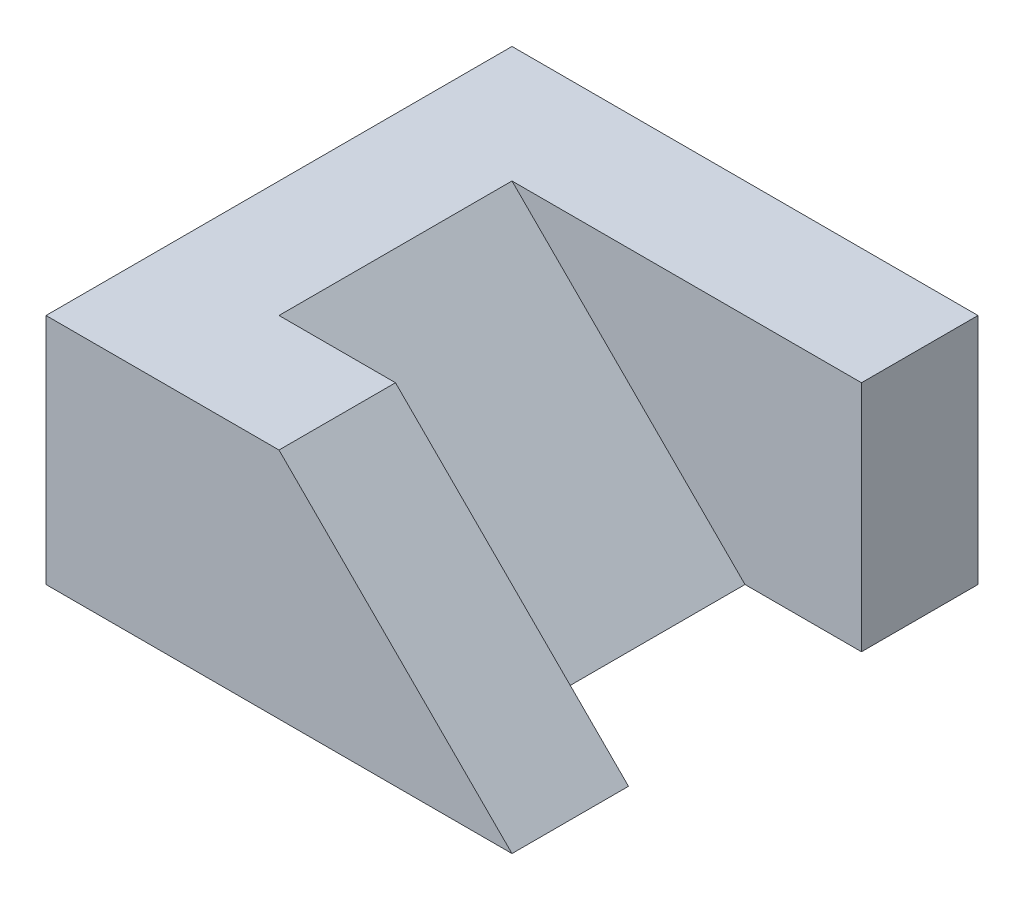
SolidWorks part; units mm, degrees
ref_plane "Front Plane" through (0, 0, 0) normal (0, 0, 1) x (1, 0, 0)
ref_plane "Top Plane" through (0, 0, 0) normal (0, 1, 0) x (1, 0, 0)
ref_plane "Right Plane" through (0, 0, 0) normal (1, 0, 0) x (0, 0, -1)
sketch "Sketch2" plane through (0, 0, 0) normal (0, 0, -1) x (1, 0, 0)
  line L0 (0, 0) -> (30, 0)
  line L1 (30, 0) -> (10, -20)
  line L2 (10, -20) -> (0, -20)
  line L3 (0, -20) -> (0, 0)
  dimension "D1" = 30
  dimension "D2" = 10
  dimension "D3" = 20
extrude "Extrude1" add sketch "Sketch2" along normal mid plane 20
sketch "Sketch3" plane through (0, 0, 10) normal (0, 0, 1) x (1, 0, 0)
  line L0 (0, 0) -> (40, 0)
  line L1 (40, 0) -> (20, 20)
  line L2 (20, 20) -> (0, 20)
  line L3 (0, 20) -> (0, 0)
  line L4 (10, 20) -> (30, 0) construction
  dimension "D1" = 40
extrude "Extrude2" add sketch "Sketch3" along normal blind 10
sketch "Sketch4" plane through (0, 0, -10) normal (0, 0, -1) x (-1, 0, 0)
  line L0 (0, 20) -> (-10, 20) construction
  line L1 (0, 0) -> (-40, 0)
  line L2 (0, 0) -> (0, 20)
  line L3 (0, 20) -> (-40, 20)
  line L4 (-40, 0) -> (-40, 20)
extrude "Extrude3" add sketch "Sketch4" along normal blind 10
